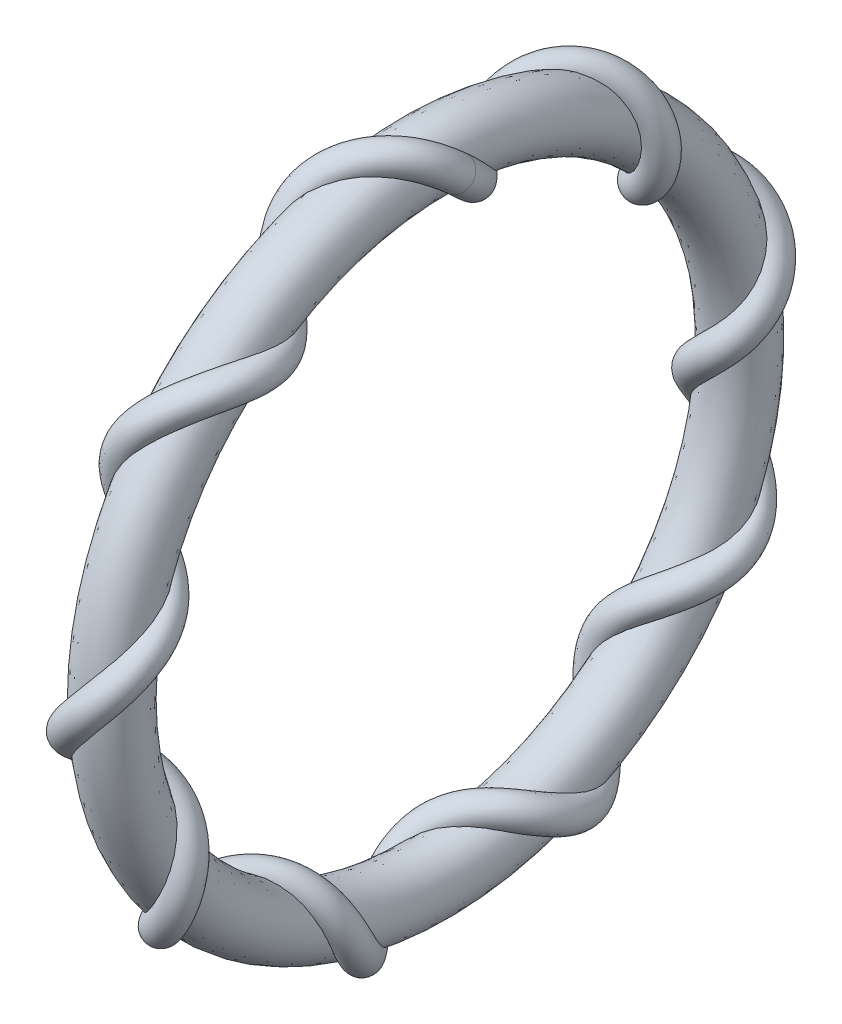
SolidWorks part; units mm, degrees
ref_plane "Płaszczyzna przednia" through (0, 0, 0) normal (0, 0, 1) x (1, 0, 0)
ref_plane "Płaszczyzna górna" through (0, 0, 0) normal (0, 1, 0) x (1, 0, 0)
ref_plane "Płaszczyzna prawa" through (0, 0, 0) normal (1, 0, 0) x (0, 0, -1)
curve "Krzywa1"
sketch "Szkic1" plane through (0, 0, 0) normal (0, 0, 1) x (1, 0, 0)
  line L0 (0, 0) -> (67.6899, 0) construction
  circle A0 centre (0, 100) radius 10
  point P5 (0, 0)
  point P6 (67.6899, 0)
  dimension "D1" = 20
  dimension "D2" = 200
revolve "Obrót1" add sketch "Szkic1" angle 360 about L0
sketch3d "Szkic 3D1"
  spline S0 degree 3 number of poles 75 (10, 100, 0) -> (10, 100, 0) construction
  spline S1 degree 3 number of poles 75 (10, 100, 0) -> (10, 100, 0)
ref_plane "Płaszczyzna1" through (10, 100, 0) normal (0.0013, 0.6684, 0.7438) x (1, -0.0009, -0.001)
sketch "Szkic2" plane through (10, 100, 0) normal (0.0013, 0.6684, 0.7438) x (1, -0.0009, -0.001)
  circle A0 centre (0, 0) radius 5
  dimension "D1" = 10
sweep "Wyciągnięcie po ścieżce1" add profiles "Szkic2" path "Szkic 3D1"
